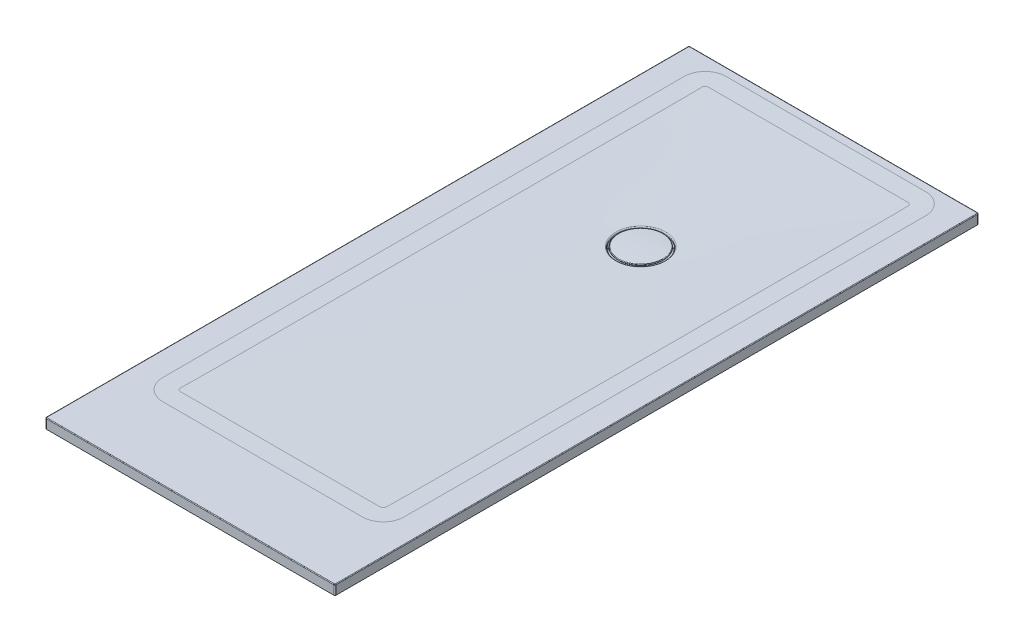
SolidWorks part; units mm, degrees
ref_plane "Płaszczyzna przednia" through (0, 0, 0) normal (0, 0, 1) x (1, 0, 0)
ref_plane "Płaszczyzna górna" through (0, 0, 0) normal (0, 1, 0) x (1, 0, 0)
ref_plane "Płaszczyzna prawa" through (0, 0, 0) normal (1, 0, 0) x (0, 0, -1)
sketch "Szkic2" plane through (0, 0, 0) normal (0, 1, 0) x (1, 0, 0)
  line L0 (0, 1000) -> (0, 400) construction
  line L1 (-450, -1000) -> (450, -1000)
  line L2 (-450, -1000) -> (-450, 1000)
  line L3 (-450, 1000) -> (450, 1000)
  line L4 (450, -1000) -> (450, 1000)
  line L5 (-450, -1000) -> (450, 1000) construction
  line L6 (-450, 1000) -> (450, -1000) construction
  line L7 (-360, 960) -> (360, 960)
  line L8 (-360, 960) -> (-360, -760)
  line L9 (-360, -760) -> (360, -760)
  line L10 (360, 960) -> (360, -760)
  line L11 (-400, 1000) -> (-400, -800) construction
  line L12 (-400, -800) -> (400, -800) construction
  line L13 (400, -800) -> (400, 1000) construction
  circle A0 centre (0, 400) radius 75
  point P0 (0, 0)
  point P11 (0, 960)
  point P16 (0, -800)
  dimension "D9" = 150
  dimension "D1" = 900
  dimension "D2" = 2000
  dimension "D3" = 40
  dimension "D4" = 90
  dimension "D5" = 40
  dimension "D6" = 50
  dimension "D7" = 1800
  dimension "D8" = 600
  dimension "D10" = 800
sketch "Szkic3" plane through (0, 0, 0) normal (0, 1, 0) x (1, 0, 0)
  line L0 (-450, -1000) -> (-450, 1000) construction
  line L1 (-450, -1000) -> (450, -1000) construction
  line L2 (450, -1000) -> (450, 1000) construction
  line L3 (-450, 1000) -> (450, 1000) construction
  line L4 (-360, 960) -> (-360, -760) construction
  line L5 (-360, 960) -> (360, 960) construction
  line L6 (360, 960) -> (360, -760) construction
  line L7 (-360, -760) -> (360, -760) construction
  line L8 (-450, -1000) -> (-450, 1000)
  line L9 (-450, -1000) -> (450, -1000)
  line L10 (450, -1000) -> (450, 1000)
  line L11 (-450, 1000) -> (450, 1000)
  line L12 (-360, 910) -> (-360, -710)
  line L13 (-310, 960) -> (310, 960)
  line L14 (360, 910) -> (360, -710)
  line L15 (-310, -760) -> (310, -760)
  arc A0 (360, 910) -> (310, 960) centre (310, 910) ccw
  arc A1 (-310, 960) -> (-360, 910) centre (-310, 910) ccw
  arc A2 (310, -760) -> (360, -710) centre (310, -710) ccw
  arc A3 (-310, -760) -> (-360, -710) centre (-310, -710) cw
  dimension "D1" = 50
surface "Powierzchnia-Płaszczyzna1" sketch "Szkic3"
sketch "Szkic4" plane through (0, 0, 0) normal (0, 1, 0) x (1, 0, 0)
  line L0 (-360, 960) -> (-360, -760) construction
  line L1 (-360, -760) -> (360, -760) construction
  line L2 (360, 960) -> (360, -760) construction
  line L3 (-360, 960) -> (360, 960) construction
  line L4 (-360, 960) -> (-360, -760)
  line L5 (-360, -760) -> (360, -760)
  line L6 (360, 960) -> (360, -760)
  line L7 (-360, 960) -> (360, 960)
ref_plane "korek" through (0, -15, 0) normal (0, 1, 0) x (-1, 0, 0)
sketch "Szkic5" plane through (0, -15, 0) normal (0, 1, 0) x (-1, 0, 0)
  circle A0 centre (0, -400) radius 75 construction
  circle A1 centre (0, -400) radius 75
surface "Powierzchnia-Wyciągnięcie po profilach2"
surface "Powierzchnia-Połącz1"
sketch "Szkic7" plane through (0, 0, 0) normal (0, 1, 0) x (1, 0, 0)
  line L27 (310, 920) -> (-310, 920)
  line L28 (-320, 910) -> (-320, -710)
  line L29 (-310, -720) -> (310, -720)
  line L30 (320, -710) -> (320, 910)
  line L31 (310, 920) -> (-310, 920)
  line L32 (-320, 910) -> (-320, -710)
  line L33 (-310, -720) -> (310, -720)
  line L34 (320, -710) -> (320, 910)
  line L35 (310, 975) -> (-310, 975)
  line L36 (-375, 910) -> (-375, -710)
  line L37 (-310, -775) -> (310, -775)
  line L38 (375, -710) -> (375, 910)
  line L39 (310, 975) -> (-310, 975)
  line L40 (-375, 910) -> (-375, -710)
  line L41 (-310, -775) -> (310, -775)
  line L42 (375, -710) -> (375, 910)
  arc A0 (320, -710) -> (310, -720) centre (310, -710) cw
  arc A1 (-320, -710) -> (-310, -720) centre (-310, -710) ccw
  arc A2 (320, 910) -> (310, 920) centre (310, 910) ccw
  arc A3 (-320, 910) -> (-310, 920) centre (-310, 910) cw
  spline S23 degree 3 poles (-640.7104, 632.4499) (119.8407, 800.6105) (327.2494, 874.5733) (319.7449, 912.2675) (319.6659, 912.5842) (319.4758, 913.2121) (319.3642, 913.5242) (318.9881, 914.432) (318.6814, 915.0061) (318.1377, 915.821) (317.9418, 916.0858) (317.524, 916.5953) (317.3041, 916.8378) (316.6128, 917.5296) (316.1099, 917.9436) (315.2909, 918.492) (315.0071, 918.6623) (314.4303, 918.9711) (314.1357, 919.1105) (313.5346, 919.3602) (313.228, 919.4703) (312.6026, 919.661) (312.2823, 919.7415) (258.4345, 930.529) (155.2462, 494.8934) (40.6754, -43.0448) knots -7.190571 -7.190571 -7.190571 -7.190571 0.125 0.125 0.1875 0.1875 0.25 0.25 0.375 0.375 0.4375 0.4375 0.5 0.5 0.625 0.625 0.6875 0.6875 0.75 0.75 0.8125 0.8125 0.875 0.875 11.233409 11.233409 11.233409 11.233409 only from (320, 910) to (310, 920)
  spline S24 degree 3 poles (-32.213, -40.6407) (-200.2803, 718.8809) (-274.4926, 927.2661) (-312.2675, 919.7449) (-312.5842, 919.6659) (-313.2121, 919.4758) (-313.5242, 919.3642) (-314.432, 918.9881) (-315.0061, 918.6814) (-315.821, 918.1377) (-316.0858, 917.9418) (-316.5953, 917.524) (-316.8378, 917.3041) (-317.5296, 916.6128) (-317.9436, 916.1099) (-318.492, 915.2909) (-318.6623, 915.0071) (-318.9711, 914.4303) (-319.1105, 914.1357) (-319.3602, 913.5346) (-319.4703, 913.228) (-319.661, 912.6026) (-319.7415, 912.2823) (-330.455, 858.7997) (99.0811, 756.6622) (643.3487, 641.7589) knots -7.206407 -7.206407 -7.206407 -7.206407 0.125 0.125 0.1875 0.1875 0.25 0.25 0.375 0.375 0.4375 0.4375 0.5 0.5 0.625 0.625 0.6875 0.6875 0.75 0.75 0.8125 0.8125 0.875 0.875 11.162754 11.162754 11.162754 11.162754 only from (-310, 920) to (-320, 910)
  spline S25 degree 3 poles (640.7107, -432.4499) (-119.8407, -600.6105) (-327.2494, -674.5733) (-319.7449, -712.2675) (-319.6659, -712.5842) (-319.4758, -713.2121) (-319.3642, -713.5242) (-318.9881, -714.432) (-318.6814, -715.0061) (-318.1377, -715.821) (-317.9418, -716.0858) (-317.524, -716.5953) (-317.3041, -716.8378) (-316.6128, -717.5296) (-316.1099, -717.9436) (-315.2909, -718.492) (-315.0071, -718.6623) (-314.4303, -718.9711) (-314.1357, -719.1105) (-313.5346, -719.3602) (-313.228, -719.4703) (-312.6026, -719.661) (-312.2823, -719.7415) (-258.4345, -730.529) (-155.2462, -294.8934) (-40.6754, 243.045) knots -7.190571 -7.190571 -7.190571 -7.190571 0.125 0.125 0.1875 0.1875 0.25 0.25 0.375 0.375 0.4375 0.4375 0.5 0.5 0.625 0.625 0.6875 0.6875 0.75 0.75 0.8125 0.8125 0.875 0.875 11.233409 11.233409 11.233409 11.233409 only from (-320, -710) to (-310, -720)
  spline S26 degree 3 poles (32.213, 240.6409) (200.2803, -518.8809) (274.4926, -727.2661) (312.2675, -719.7449) (312.5842, -719.6659) (313.2121, -719.4758) (313.5242, -719.3642) (314.432, -718.9881) (315.0061, -718.6814) (315.821, -718.1377) (316.0858, -717.9418) (316.5953, -717.524) (316.8378, -717.3041) (317.5296, -716.6128) (317.9436, -716.1099) (318.492, -715.2909) (318.6623, -715.0071) (318.9711, -714.4303) (319.1105, -714.1357) (319.3602, -713.5346) (319.4703, -713.228) (319.661, -712.6026) (319.7415, -712.2823) (330.455, -658.7997) (-99.0811, -556.6622) (-643.3487, -441.7589) knots -7.206407 -7.206407 -7.206407 -7.206407 0.125 0.125 0.1875 0.1875 0.25 0.25 0.375 0.375 0.4375 0.4375 0.5 0.5 0.625 0.625 0.6875 0.6875 0.75 0.75 0.8125 0.8125 0.875 0.875 11.162754 11.162754 11.162754 11.162754 only from (310, -720) to (320, -710)
  spline S31 degree 3 poles (-2446.3029, -67.8399) (-195.8051, 485.5015) (406.4429, 758.1469) (373.3422, 924.7388) (372.8284, 926.7972) (371.9015, 929.8582) (371.5658, 930.8758) (370.8441, 932.8943) (370.4597, 933.8906) (368.4228, 938.8081) (366.4285, 942.54) (363.4837, 946.9543) (362.8719, 947.8245) (361.6021, 949.5394) (360.9423, 950.3861) (358.9053, 952.8702) (357.4763, 954.4465) (352.9828, 958.9432) (349.7137, 961.6339) (345.2775, 964.6044) (344.37, 965.1801) (342.5355, 966.2813) (341.6081, 966.8072) (338.796, 968.3122) (336.8815, 969.2188) (332.9741, 970.8413) (330.9812, 971.5573) (327.9324, 972.4865) (326.9061, 972.772) (324.8335, 973.2938) (323.785, 973.5304) (125.9698, 1013.0698) (-172.9721, 132.9552) (-596.4863, -1868.1376) knots -4.828764 -4.828764 -4.828764 -4.828764 0.125 0.125 0.1875 0.1875 0.21875 0.21875 0.25 0.25 0.375 0.375 0.40625 0.40625 0.4375 0.4375 0.5 0.5 0.625 0.625 0.65625 0.65625 0.6875 0.6875 0.75 0.75 0.8125 0.8125 0.84375 0.84375 0.875 0.875 6.733156 6.733156 6.733156 6.733156 only from (375, 910) to (310, 975)
  spline S32 degree 3 poles (667.9432, -1846.2288) (114.6221, 403.9071) (-158.1116, 1006.4504) (-324.7388, 973.3422) (-326.7972, 972.8284) (-329.8582, 971.9015) (-330.8758, 971.5658) (-332.8943, 970.8441) (-333.8906, 970.4597) (-338.8081, 968.4228) (-342.54, 966.4285) (-346.9543, 963.4837) (-347.8245, 962.8719) (-349.5394, 961.6021) (-350.3861, 960.9423) (-352.8702, 958.9053) (-354.4464, 957.4763) (-358.9432, 952.9828) (-361.6339, 949.7137) (-364.6044, 945.2775) (-365.1801, 944.37) (-366.2813, 942.5355) (-366.8072, 941.6081) (-368.3122, 938.796) (-369.2188, 936.8814) (-370.8413, 932.9741) (-371.5573, 930.9812) (-372.4865, 927.9324) (-372.772, 926.9061) (-373.2938, 924.8335) (-373.5304, 923.785) (-413.0557, 726.0378) (466.4023, 427.2402) (2468.1723, 3.7243) knots -4.829834 -4.829834 -4.829834 -4.829834 0.125 0.125 0.1875 0.1875 0.21875 0.21875 0.25 0.25 0.375 0.375 0.40625 0.40625 0.4375 0.4375 0.5 0.5 0.625 0.625 0.65625 0.65625 0.6875 0.6875 0.75 0.75 0.8125 0.8125 0.84375 0.84375 0.875 0.875 6.731129 6.731129 6.731129 6.731129 only from (-310, 975) to (-375, 910)
  spline S33 degree 3 poles (2446.3031, 267.8399) (195.8051, -285.5015) (-406.4429, -558.1469) (-373.3422, -724.7388) (-372.8284, -726.7972) (-371.9015, -729.8582) (-371.5658, -730.8758) (-370.8441, -732.8943) (-370.4597, -733.8906) (-368.4228, -738.8081) (-366.4285, -742.54) (-363.4837, -746.9543) (-362.8719, -747.8245) (-361.6021, -749.5394) (-360.9423, -750.3861) (-358.9053, -752.8702) (-357.4763, -754.4465) (-352.9828, -758.9432) (-349.7137, -761.6339) (-345.2775, -764.6044) (-344.37, -765.1801) (-342.5355, -766.2813) (-341.6081, -766.8072) (-338.796, -768.3122) (-336.8815, -769.2188) (-332.9741, -770.8413) (-330.9812, -771.5573) (-327.9324, -772.4865) (-326.9061, -772.772) (-324.8335, -773.2938) (-323.785, -773.5304) (-125.9698, -813.0698) (172.9721, 67.0448) (596.4863, 2068.1376) knots -4.828764 -4.828764 -4.828764 -4.828764 0.125 0.125 0.1875 0.1875 0.21875 0.21875 0.25 0.25 0.375 0.375 0.40625 0.40625 0.4375 0.4375 0.5 0.5 0.625 0.625 0.65625 0.65625 0.6875 0.6875 0.75 0.75 0.8125 0.8125 0.84375 0.84375 0.875 0.875 6.733156 6.733156 6.733156 6.733156 only from (-375, -710) to (-310, -775)
  spline S34 degree 3 poles (-667.9432, 2046.2288) (-114.6221, -203.9071) (158.1116, -806.4504) (324.7388, -773.3422) (326.7972, -772.8284) (329.8582, -771.9015) (330.8758, -771.5658) (332.8943, -770.8441) (333.8906, -770.4597) (338.8081, -768.4228) (342.54, -766.4285) (346.9543, -763.4837) (347.8245, -762.8719) (349.5394, -761.6021) (350.3861, -760.9423) (352.8702, -758.9053) (354.4464, -757.4763) (358.9432, -752.9828) (361.6339, -749.7137) (364.6044, -745.2775) (365.1801, -744.37) (366.2813, -742.5355) (366.8072, -741.6081) (368.3122, -738.796) (369.2188, -736.8814) (370.8413, -732.9741) (371.5573, -730.9812) (372.4865, -727.9324) (372.772, -726.9061) (373.2938, -724.8335) (373.5304, -723.785) (413.0557, -526.0378) (-466.4023, -227.2402) (-2468.1723, 196.2757) knots -4.829834 -4.829834 -4.829834 -4.829834 0.125 0.125 0.1875 0.1875 0.21875 0.21875 0.25 0.25 0.375 0.375 0.40625 0.40625 0.4375 0.4375 0.5 0.5 0.625 0.625 0.65625 0.65625 0.6875 0.6875 0.75 0.75 0.8125 0.8125 0.84375 0.84375 0.875 0.875 6.731129 6.731129 6.731129 6.731129 only from (310, -775) to (375, -710)
  spline S35 degree 3 poles (375, 910) (375, 914.2918) (374.5794, 918.5119) (373.3422, 924.7388) (372.8284, 926.7972) (371.9015, 929.8582) (371.5658, 930.8758) (370.8441, 932.8943) (370.4597, 933.8906) (368.4228, 938.8081) (366.4285, 942.54) (363.4837, 946.9543) (362.8719, 947.8245) (361.6021, 949.5394) (360.9423, 950.3861) (358.9053, 952.8702) (357.4763, 954.4465) (352.9828, 958.9432) (349.7137, 961.6339) (345.2775, 964.6044) (344.37, 965.1801) (342.5355, 966.2813) (341.6081, 966.8072) (338.796, 968.3122) (336.8815, 969.2188) (332.9741, 970.8413) (330.9812, 971.5573) (327.9324, 972.4865) (326.9061, 972.772) (324.8335, 973.2938) (323.785, 973.5304) (318.5369, 974.5794) (314.2918, 975) (310, 975) knots 0 0 0 0 0.125 0.125 0.1875 0.1875 0.21875 0.21875 0.25 0.25 0.375 0.375 0.40625 0.40625 0.4375 0.4375 0.5 0.5 0.625 0.625 0.65625 0.65625 0.6875 0.6875 0.75 0.75 0.8125 0.8125 0.84375 0.84375 0.875 0.875 1 1 1 1
  spline S36 degree 3 poles (-310, 975) (-314.2918, 975) (-318.5119, 974.5794) (-324.7388, 973.3422) (-326.7972, 972.8284) (-329.8582, 971.9015) (-330.8758, 971.5658) (-332.8943, 970.8441) (-333.8906, 970.4597) (-338.8081, 968.4228) (-342.54, 966.4285) (-346.9543, 963.4837) (-347.8245, 962.8719) (-349.5394, 961.6021) (-350.3861, 960.9423) (-352.8702, 958.9053) (-354.4464, 957.4763) (-358.9432, 952.9828) (-361.6339, 949.7137) (-364.6044, 945.2775) (-365.1801, 944.37) (-366.2813, 942.5355) (-366.8072, 941.6081) (-368.3122, 938.796) (-369.2188, 936.8814) (-370.8413, 932.9741) (-371.5573, 930.9812) (-372.4865, 927.9324) (-372.772, 926.9061) (-373.2938, 924.8335) (-373.5304, 923.785) (-374.5794, 918.5369) (-375, 914.2918) (-375, 910) knots 0 0 0 0 0.125 0.125 0.1875 0.1875 0.21875 0.21875 0.25 0.25 0.375 0.375 0.40625 0.40625 0.4375 0.4375 0.5 0.5 0.625 0.625 0.65625 0.65625 0.6875 0.6875 0.75 0.75 0.8125 0.8125 0.84375 0.84375 0.875 0.875 1 1 1 1
  spline S37 degree 3 poles (-375, -710) (-375, -714.2918) (-374.5794, -718.5119) (-373.3422, -724.7388) (-372.8284, -726.7972) (-371.9015, -729.8582) (-371.5658, -730.8758) (-370.8441, -732.8943) (-370.4597, -733.8906) (-368.4228, -738.8081) (-366.4285, -742.54) (-363.4837, -746.9543) (-362.8719, -747.8245) (-361.6021, -749.5394) (-360.9423, -750.3861) (-358.9053, -752.8702) (-357.4763, -754.4465) (-352.9828, -758.9432) (-349.7137, -761.6339) (-345.2775, -764.6044) (-344.37, -765.1801) (-342.5355, -766.2813) (-341.6081, -766.8072) (-338.796, -768.3122) (-336.8815, -769.2188) (-332.9741, -770.8413) (-330.9812, -771.5573) (-327.9324, -772.4865) (-326.9061, -772.772) (-324.8335, -773.2938) (-323.785, -773.5304) (-318.5369, -774.5794) (-314.2918, -775) (-310, -775) knots 0 0 0 0 0.125 0.125 0.1875 0.1875 0.21875 0.21875 0.25 0.25 0.375 0.375 0.40625 0.40625 0.4375 0.4375 0.5 0.5 0.625 0.625 0.65625 0.65625 0.6875 0.6875 0.75 0.75 0.8125 0.8125 0.84375 0.84375 0.875 0.875 1 1 1 1
  spline S38 degree 3 poles (310, -775) (314.2918, -775) (318.5119, -774.5794) (324.7388, -773.3422) (326.7972, -772.8284) (329.8582, -771.9015) (330.8758, -771.5658) (332.8943, -770.8441) (333.8906, -770.4597) (338.8081, -768.4228) (342.54, -766.4285) (346.9543, -763.4837) (347.8245, -762.8719) (349.5394, -761.6021) (350.3861, -760.9423) (352.8702, -758.9053) (354.4464, -757.4763) (358.9432, -752.9828) (361.6339, -749.7137) (364.6044, -745.2775) (365.1801, -744.37) (366.2813, -742.5355) (366.8072, -741.6081) (368.3122, -738.796) (369.2188, -736.8814) (370.8413, -732.9741) (371.5573, -730.9812) (372.4865, -727.9324) (372.772, -726.9061) (373.2938, -724.8335) (373.5304, -723.785) (374.5794, -718.5369) (375, -714.2918) (375, -710) knots 0 0 0 0 0.125 0.125 0.1875 0.1875 0.21875 0.21875 0.25 0.25 0.375 0.375 0.40625 0.40625 0.4375 0.4375 0.5 0.5 0.625 0.625 0.65625 0.65625 0.6875 0.6875 0.75 0.75 0.8125 0.8125 0.84375 0.84375 0.875 0.875 1 1 1 1
  dimension "D3" = 10
  dimension "D1" = 40
  dimension "D2" = 15
other "Usuń ścianę1"
other "Granica-Powierzchnia1"
surface "Powierzchnia-Połącz2"
sketch "Szkic9" plane through (0, 0, 0) normal (0, 1, 0) x (1, 0, 0)
  line L0 (-450, -1000) -> (450, -1000) construction
  line L1 (-450, -1000) -> (-450, 1000) construction
  line L2 (450, -1000) -> (450, 1000) construction
  line L3 (-450, 1000) -> (450, 1000) construction
  line L4 (-450, -1000) -> (450, -1000)
  line L5 (-450, -1000) -> (-450, 1000)
  line L6 (450, -1000) -> (450, 1000)
  line L7 (-450, 1000) -> (450, 1000)
surface "Powierzchnia-Wyciągnięcie1" sketch "Szkic9" parameters "D1"=30
sketch "Szkic8" plane through (0, 0, 0) normal (1, 0, 0) x (0, 0, -1)
  line L0 (400, 0) -> (400, -30) construction
  line L1 (325, -15) -> (325.2968, -23.5)
  line L4 (325.2968, -23.5) -> (348, -24.0945)
  line L5 (325.2968, -23.5) -> (400, -23.5) construction
  line L6 (348, -24.0945) -> (348, -30) construction
  line L7 (400, -30) -> (325.2968, -30) construction
  line L8 (325.2968, -30) -> (325.2968, -23.5) construction
  line L9 (355, -28) -> (355, -30)
  line L10 (348, -24.0945) -> (355, -28)
  dimension "D1" = 30
  dimension "D2" = 8.5
  dimension "D3" = 2
  dimension "D4" = 1.5
  dimension "D5" = 52
  dimension "D6" = 45
  dimension "D7" = 2
surface "Powierzchnia-Obrót1" sketch "Szkic8" parameters "D1"=360
surface "Powierzchnia-Płaszczyzna2"
surface "Powierzchnia-Połącz3"
fillet "Zaokrąglenie4" radius 4 4 edges at (-450, -15, -1000) (450, -15, -1000) (-450, -15, 1000) (450, -15, 1000)
fillet "Zaokrąglenie5" radius 3 3 edges at (0, -24.0945, -452) (0, -23.5, -474.7032)
fillet "Zaokrąglenie6" radius 2 9 edges at (448.8284, 0, 998.8284) (0, 0, 1000) (-448.8284, 0, 998.8284) (-450, 0, 0) (-448.8284, 0, -998.8284) (0, 0, -1000) (448.8284, 0, -998.8284) (450, 0, 0) (0, -28, -445)
sketch "Szkic11" plane through (0, 0, 0) normal (1, 0, 0) x (0, 0, -1)
  line L0 (400, 0) -> (400, -30) construction
  line L1 (-996, -30) -> (996, -30) construction
  line L2 (400, -17) -> (400, -11.5)
  line L14 (470, -11.5) -> (470, -14.5) construction
  line L16 (470, -17) -> (400, -17)
  line L18 (470, -17) -> (470, -16.3377)
  line L19 (400, -11.5) -> (470, -11.5) construction
  arc A0 (470, -16.3377) -> (468.1666, -14.3446) centre (468, -16.3377) ccw
  arc A6 (468.1666, -14.3446) -> (400, -11.5) centre (400, -829.6667) ccw
  dimension "D2" = 2
  dimension "D8" = 2.5
  dimension "D9" = 17
  dimension "D10" = 5.5
  dimension "D11" = 70
revolve "Obrót1" add sketch "Szkic11" angle 360 about L0
